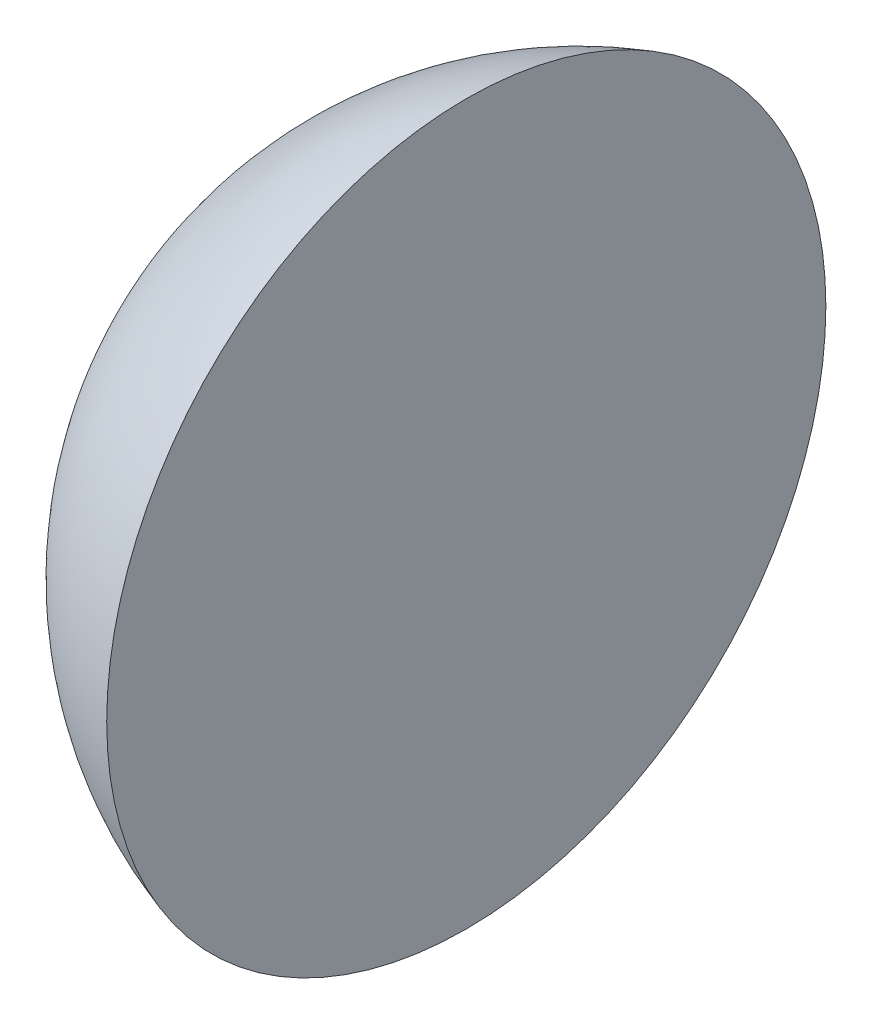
SolidWorks part; units mm, degrees
ref_plane "Vorne" through (0, 0, 0) normal (0, 0, 1) x (1, 0, 0)
ref_plane "Oben" through (0, 0, 0) normal (0, 1, 0) x (1, 0, 0)
ref_plane "Rechts" through (0, 0, 0) normal (1, 0, 0) x (0, 0, -1)
sketch "Skizze1" plane through (0, 0, 0) normal (0, 0, 1) x (1, 0, 0)
  line L0 (53.5443, 1.7) -> (53.5443, 0) construction
  line L2 (0, 0) -> (79.1682, 0) construction
  line L3 (53.5443, 1.7) -> (53.5443, 0)
  line L4 (0, 0) -> (53.5443, 0) construction
  line L5 (0, 0) -> (50.2158, 0) construction
  line L7 (65.695, 0) -> (79.1682, 0) construction
  line L9 (65.695, 0) -> (79.1682, 0) construction
  line L10 (52.295, 0) -> (53.5443, 0)
  arc A1 (53.5443, 1.7) -> (52.295, 0) centre (54.0763, 0) ccw construction
  arc A2 (53.5443, 1.7) -> (52.295, 0) centre (54.0763, 0) ccw
revolve "Rotation1" add sketch "Skizze1" angle 360 about L10
